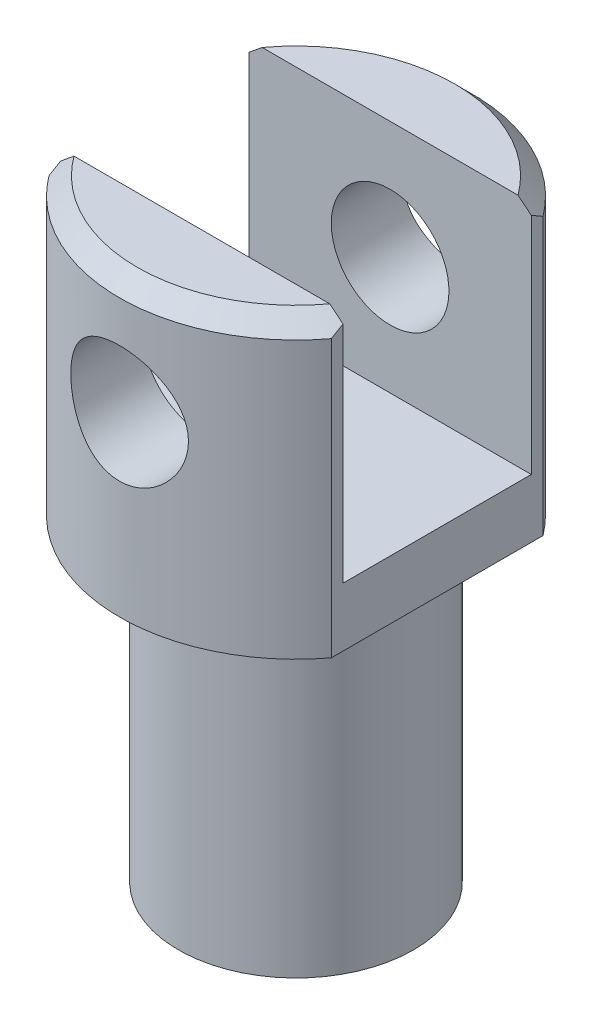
SolidWorks part; units mm, degrees
ref_plane "Face" through (0, 0, 0) normal (0, 0, 1) x (1, 0, 0)
ref_plane "Gauche" through (0, 0, 0) normal (0, 1, 0) x (1, 0, 0)
ref_plane "Dessus" through (0, 0, 0) normal (1, 0, 0) x (0, 0, -1)
sketch "Esquisse1" plane through (0, 0, 0) normal (0, 0, 1) x (1, 0, 0)
  line L0 (0, 40) -> (0, -40) construction
  line L1 (0, 26) -> (13.5, 26)
  line L2 (13.5, 26) -> (15, 24.5)
  line L3 (15, 24.5) -> (15, 1)
  line L4 (15, 1) -> (10, 1)
  line L5 (10, 1) -> (10, -26)
  line L6 (10, -26) -> (0, -26)
  line L7 (0, -26) -> (0, 26)
  dimension "D1" = 45
  dimension "D2" = 1.5
  dimension "D3" = 52
  dimension "D4" = 15
  dimension "D5" = 10
  dimension "D6" = 27
revolve "Base-Révolution" add sketch "Esquisse1" angle 360 about L0
sketch "Esquisse3" plane through (0, 26, 0) normal (0, 1, 0) x (-1, 0, 0)
  line L0 (12.6886, -8) -> (-12.6886, -8)
  line L1 (12.6886, 8) -> (-12.6886, 8)
  circle A0 centre (0, 0) radius 15 construction
  arc A1 (12.6886, -8) -> (12.6886, 8) centre (0, 0) ccw
  arc A2 (-12.6886, 8) -> (-12.6886, -8) centre (0, 0) ccw
  dimension "D1" = 8
  dimension "D2" = 16
extrude "Enlèv. mat.-Extru.1" cut sketch "Esquisse3" against normal blind 20
ref_plane "Plan2" through (15, 12.75, 0) normal (1, 0, 0) x (0, 0, -1)
sketch "Esquisse4" plane through (15, 12.75, 0) normal (1, 0, 0) x (0, 0, -1)
  line L0 (-15, -11.75) -> (15, -11.75) construction
  line L1 (12, -11.75) -> (-12, -11.75)
  line L2 (12, -11.75) -> (12, 13.25)
  line L3 (12, 13.25) -> (-12, 13.25)
  line L4 (-12, -11.75) -> (-12, 13.25)
  line L5 (-8, 13.25) -> (-13.5, 13.25) construction
  dimension "D1" = 24
  dimension "D2" = 12
extrude "Enlèv. mat.-Extru.2" cut sketch "Esquisse4" against normal blind 3
mirror "Symétrie1" about plane through (0, 0, 0) normal (1, 0, 0)
ref_plane "Plan3" through (0, 0, 15) normal (0, 0, 1) x (1, 0, 0)
sketch "Esquisse7" plane through (0, 0, 15) normal (0, 0, 1) x (1, 0, 0)
  line L0 (-10, 1) -> (-10, -26) construction
  line L1 (-10, -26) -> (10, -26) construction
  circle A0 centre (0, 16) radius 5
  dimension "D3" = 10
  dimension "D1" = 10
  dimension "D2" = 42
extrude "Enlèv. mat.-Extru.3" cut sketch "Esquisse7" against normal through all
hole_wizard "Perçage1" positions "Esquisse9" profile "Esquisse8" tap size "M10x1.5" standard "ISO"
sketch "Esquisse9" plane through (0, -26, 0) normal (0, -1, 0) x (1, 0, 0)
  circle A0 centre (0, 0) radius 10 construction
  point P0 (0, 0)
sketch "Esquisse8" plane through (0, -26, 0) normal (1, 0, 0) x (0, 0, -1)
  line L0 (0, 0) -> (0, 30.0537)
  line L1 (0, 30.0537) -> (4.25, 27.5)
  line L2 (4.25, 27.5) -> (4.25, 0)
  line L5 (4.25, 0) -> (0, 0)
  line L10 (0, 30.0537) -> (-4.25, 27.5) construction
  line L11 (0, -6.35) -> (0, 107.95) construction
  dimension "Diamètre du perçage" = 8.5
  dimension "Profondeur du perçage" = 27.5
  dimension "Angle de pointe" = 118
sketch "Esquisse10" plane through (0, 0, 0) normal (0, 0, 1) x (1, 0, 0)
  line L0 (0, -10) -> (0, -50) construction
  line L1 (0, -75) -> (0, 16) construction
  line L2 (-10, -26) -> (10, -26) construction
  line L3 (0, -42) -> (-6.5, -42)
  line L4 (0, -42) -> (0, -26)
  line L5 (0, -26) -> (-6.5, -26)
  line L6 (-6.5, -42) -> (-6.5, -40.5)
  line L7 (-6.5, -39) -> (-6.5, -26)
  line L8 (-6.5, -39) -> (-5, -39)
  line L10 (-6.5, -40.5) -> (-5, -40.5)
  line L11 (-5, -39) -> (-5, -40.5)
  dimension "D1" = 6.5
  dimension "D2" = 1.5
  dimension "D3" = 1.5
  dimension "D4" = 1.5
  dimension "D5" = 13
revolve "Boss.-Révol.1" [suppressed] add sketch "Esquisse10" angle 360 about L0
